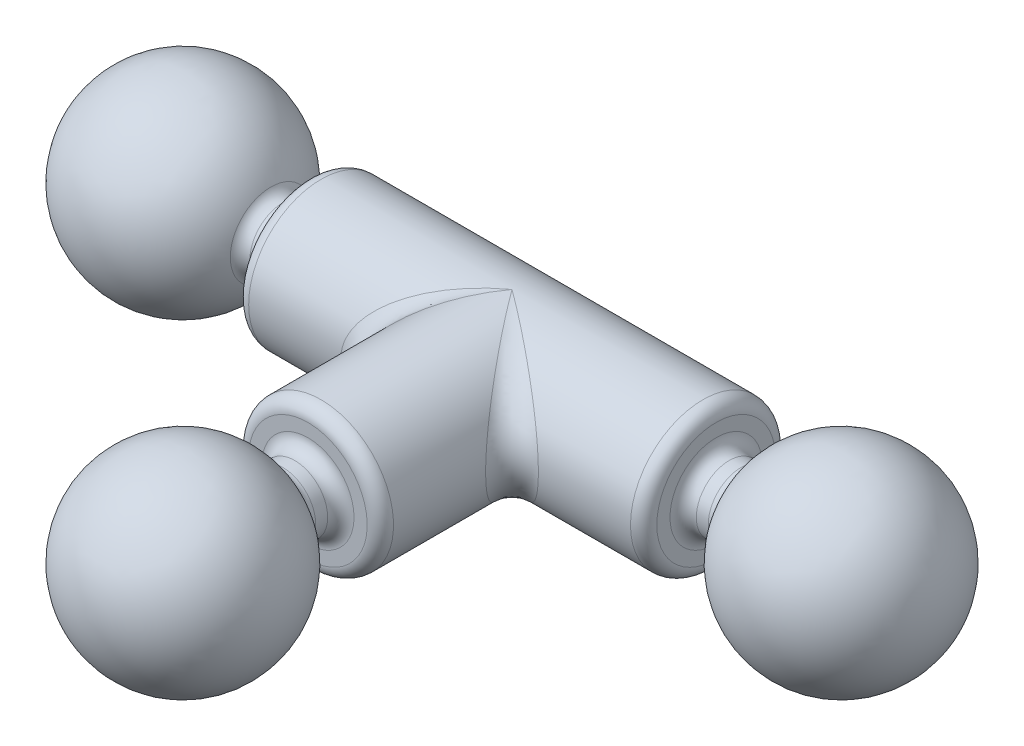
SolidWorks part; units mm, degrees
ref_plane "Front Plane" through (0, 0, 0) normal (0, 0, 1) x (1, 0, 0)
ref_plane "Top Plane" through (0, 0, 0) normal (0, 1, 0) x (1, 0, 0)
ref_plane "Right Plane" through (0, 0, 0) normal (1, 0, 0) x (0, 0, -1)
sketch "Sketch1" plane through (0, 0, 0) normal (0, 0, 1) x (1, 0, 0)
  line L0 (-9.3472, 0) -> (72.8472, 0)
  line L1 (50.165, 6.985) -> (13.335, 6.985)
  line L2 (12.065, 5.715) -> (12.065, 4.445)
  line L3 (10.795, 3.175) -> (9.6419, 3.175)
  line L4 (31.75, -6.6514) -> (31.75, 11.8016) construction
  line L5 (52.705, 3.175) -> (53.8581, 3.175)
  line L6 (51.435, 5.715) -> (51.435, 4.445)
  line L7 (-26.1056, 0) -> (79.3298, 0) construction
  arc A0 (8.4886, 3.9133) -> (-9.3472, 0) centre (0, 0) ccw
  arc A1 (13.335, 6.985) -> (12.065, 5.715) centre (13.335, 5.715) ccw
  arc A2 (12.065, 4.445) -> (10.795, 3.175) centre (10.795, 4.445) cw
  arc A3 (9.6419, 3.175) -> (8.4886, 3.9133) centre (9.6419, 4.445) cw
  arc A4 (53.8581, 3.175) -> (55.0114, 3.9133) centre (53.8581, 4.445) ccw
  arc A5 (51.435, 4.445) -> (52.705, 3.175) centre (52.705, 4.445) ccw
  arc A6 (50.165, 6.985) -> (51.435, 5.715) centre (50.165, 5.715) cw
  arc A7 (55.0114, 3.9133) -> (72.8472, 0) centre (63.5, 0) cw
  point P1 (31.75, 0)
  point P28 (31.75, 6.985)
  dimension "D2" = 9.3472
  dimension "D5" = 1.27
  dimension "D1" = 31.75
  dimension "D3" = 3.175
  dimension "D4" = 6.985
  dimension "D6" = 12.065
revolve "Revolve1" add sketch "Sketch1" angle 360 about L7
ref_plane "Plane1" through (31.75, 0, 0) normal (1, 0, 0) x (0, 0, -1)
sketch "Sketch2" plane through (31.75, 0, -31.75) normal (-1, 0, 0) x (0, 0, 1)
  line L0 (31.75, 0) -> (72.8472, 0)
  line L1 (50.165, 6.985) -> (31.75, 6.985)
  line L4 (31.75, -6.6514) -> (31.75, 11.8016) construction
  line L5 (52.705, 3.175) -> (53.8581, 3.175)
  line L6 (51.435, 5.715) -> (51.435, 4.445)
  line L7 (17.7874, 0) -> (79.3298, 0) construction
  line L8 (76.9569, 0) -> (-13.4569, 0) construction
  line L9 (31.75, -11.6318) -> (31.75, 11.6318) construction
  line L10 (31.75, 6.985) -> (31.75, 0)
  arc A7 (55.0114, 3.9133) -> (72.8472, 0) centre (63.5, 0) cw
  arc A8 (51.435, 5.715) -> (50.165, 6.985) centre (50.165, 5.715) ccw
  arc A9 (51.435, 4.445) -> (52.705, 3.175) centre (52.705, 4.445) ccw
  arc A10 (53.8581, 3.175) -> (55.0114, 3.9133) centre (53.8581, 4.445) ccw
  point P1 (31.75, 0)
  point P28 (31.75, 6.985)
  dimension "D2" = 6.985
  dimension "D5" = 1.27
  dimension "D3" = 9.3472
  dimension "D1" = 3.175
  dimension "D4" = 31.75
  dimension "D7" = 19.685
revolve "Revolve2" add sketch "Sketch2" angle 360 about L7
fillet "Fillet1" radius 2.54 2 edges at (38.735, 0, 6.985) (24.765, 0, 6.985)
